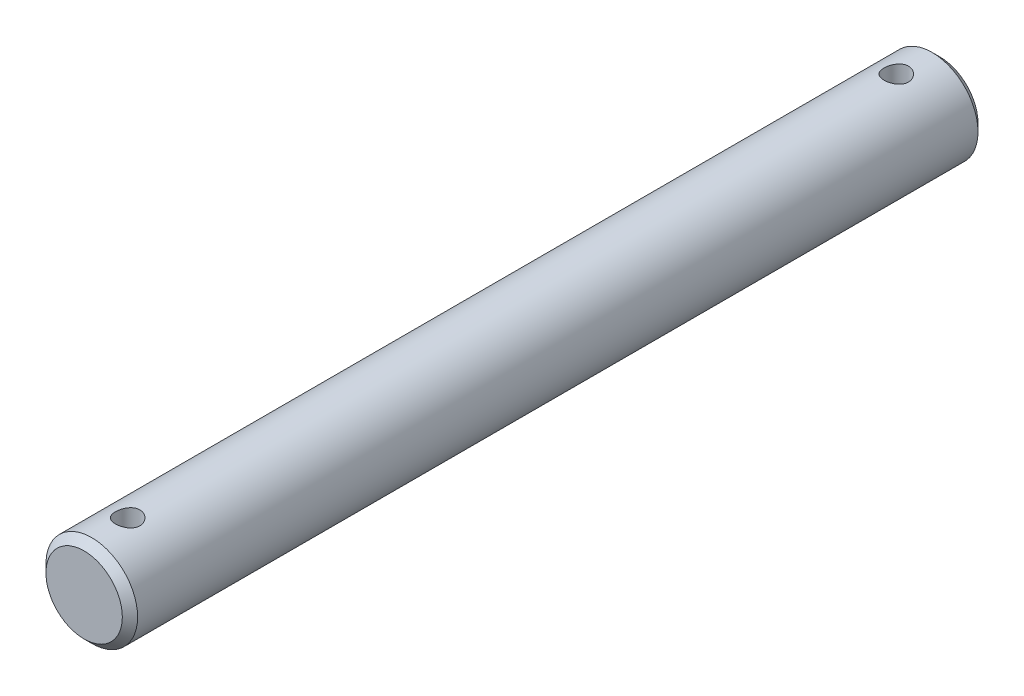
SolidWorks part; units mm, degrees
ref_plane "Frontal" through (0, 0, 0) normal (0, 0, 1) x (1, 0, 0)
ref_plane "Horizontal" through (0, 0, 0) normal (0, 1, 0) x (1, 0, 0)
ref_plane "Vertical" through (0, 0, 0) normal (1, 0, 0) x (0, 0, -1)
sketch "Esquisse1" plane through (0, 0, 0) normal (0, 0, 1) x (1, 0, 0)
  circle A0 centre (0, 0) radius 3
  dimension "D1" = 6
extrude "Extrusion1" add sketch "Esquisse1" along normal mid plane 56
chamfer "Chanfrein1" distance 0.5 angle 45 2 edges at (3, 0, -28) (3, 0, 28)
sketch "Esquisse2" plane through (0, 0, 0) normal (0, 1, 0) x (1, 0, 0)
  line L0 (0, 22.2486) -> (0, -22.7922) construction
  line L1 (-16.7738, 0) -> (15.143, 0) construction
  circle A0 centre (0, 25.15) radius 0.8
  circle A1 centre (0, -25.15) radius 0.8
  dimension "D1" = 1.6
  dimension "D2" = 50.3
extrude "Extrusion2" cut sketch "Esquisse2" against normal through all and the other way through all
